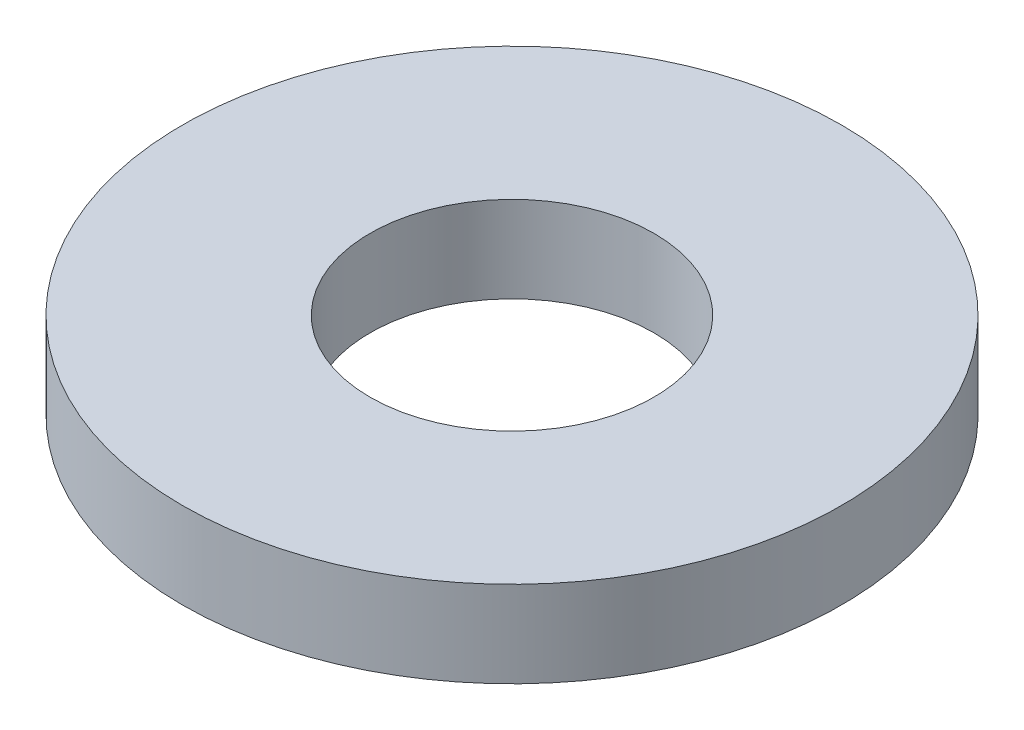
SolidWorks part; units mm, degrees
ref_plane "Front Plane" through (0, 0, 0) normal (0, 0, 1) x (1, 0, 0)
ref_plane "Top Plane" through (0, 0, 0) normal (0, 1, 0) x (1, 0, 0)
ref_plane "Right Plane" through (0, 0, 0) normal (1, 0, 0) x (0, 0, -1)
sketch "Sketch1" plane through (0, 0, 0) normal (0, 1, 0) x (1, 0, 0)
  circle A0 centre (0, 0) radius 3.556
  circle A1 centre (0, 0) radius 8.255
  dimension "D1" = 7.112
  dimension "D2" = 16.51
extrude "Boss-Extrude1" add sketch "Sketch1" along normal blind 2.159
